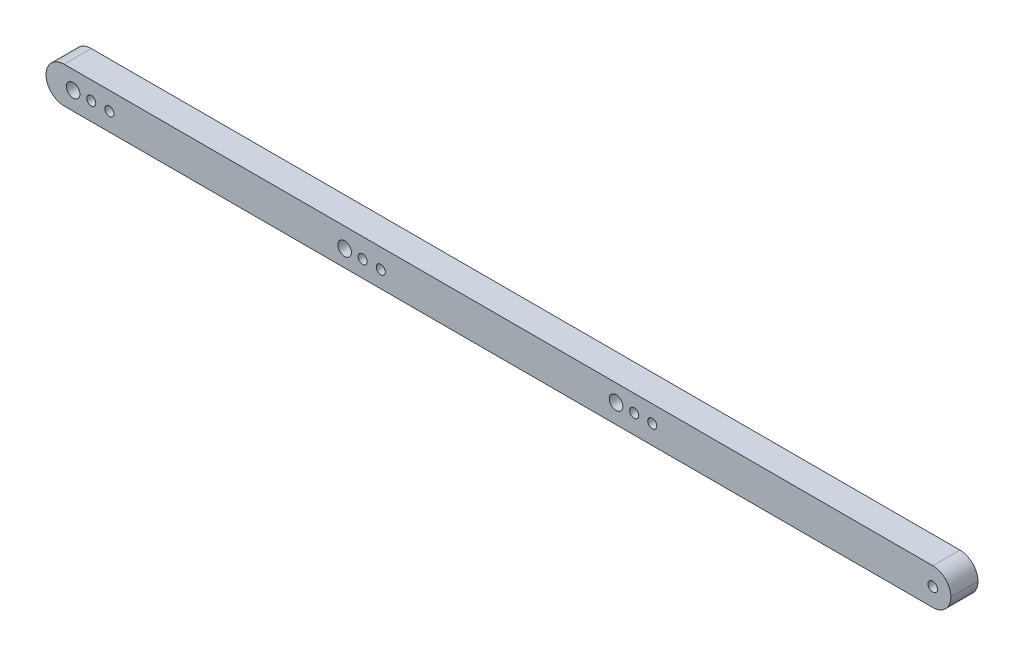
SolidWorks part; units mm, degrees
ref_plane "Face" through (0, 0, 0) normal (0, 0, 1) x (1, 0, 0)
ref_plane "Dessus" through (0, 0, 0) normal (0, 1, 0) x (1, 0, 0)
ref_plane "Droite" through (0, 0, 0) normal (1, 0, 0) x (0, 0, -1)
sketch "Esquisse1" plane through (0, 0, 0) normal (0, 0, 1) x (1, 0, 0)
  line L1 (0, 0) -> (-200, 0)
  line L2 (0, 0) -> (0, 8)
  line L3 (0, 8) -> (-200, 8)
  line L4 (-200, 0) -> (-200, 8)
  dimension "D1" = 8
  dimension "D2" = 200
extrude "Extrusion1" add sketch "Esquisse1" along normal blind 6
fillet "Congé1" radius 4 8 edges at (-200, 4, 6) (0, 4, 6) (-200, 4, 0) (0, 4, 0) (0, 0, 3) (-200, 0, 3) (-200, 8, 3) (0, 8, 3)
sketch "Esquisse2" plane through (0, 0, 6) normal (0, 0, 1) x (1, 0, 0)
  line L0 (-74, 12.0538) -> (-74, -3.6028) construction
  line L1 (-134, 12.9703) -> (-134, -5.5885) construction
  line L2 (-194, 13.9632) -> (-194, -5.5885) construction
  line L3 (-4, 8) -> (-196, 8) construction
  circle A0 centre (-4, 4) radius 1.05
  circle A1 centre (-74, 4.2255) radius 1.5
  circle A2 centre (-70, 4.2255) radius 1
  circle A3 centre (-66, 4.2255) radius 1
  circle A4 centre (-134, 3.6909) radius 1.5
  circle A5 centre (-130, 3.6909) radius 1
  circle A6 centre (-126, 3.6909) radius 1
  circle A7 centre (-194, 4) radius 1.5
  circle A8 centre (-190, 4) radius 1
  circle A9 centre (-186, 4) radius 1
  dimension "D1" = 4
  dimension "D2" = 2.1
  dimension "D3" = 3
  dimension "D4" = 2
  dimension "D5" = 2
  dimension "D6" = 4
  dimension "D7" = 4
  dimension "D9" = 3
  dimension "D10" = 2
  dimension "D11" = 2
  dimension "D13" = 4
  dimension "D15" = 3
  dimension "D16" = 2
  dimension "D17" = 2
  dimension "D19" = 4
  dimension "D21" = 4
  dimension "D8" = 70
  dimension "D12" = 4
  dimension "D14" = 130
  dimension "D18" = 4
  dimension "D20" = 190
extrude "Enlèv. mat.-Extru.1" cut sketch "Esquisse2" against normal through all
